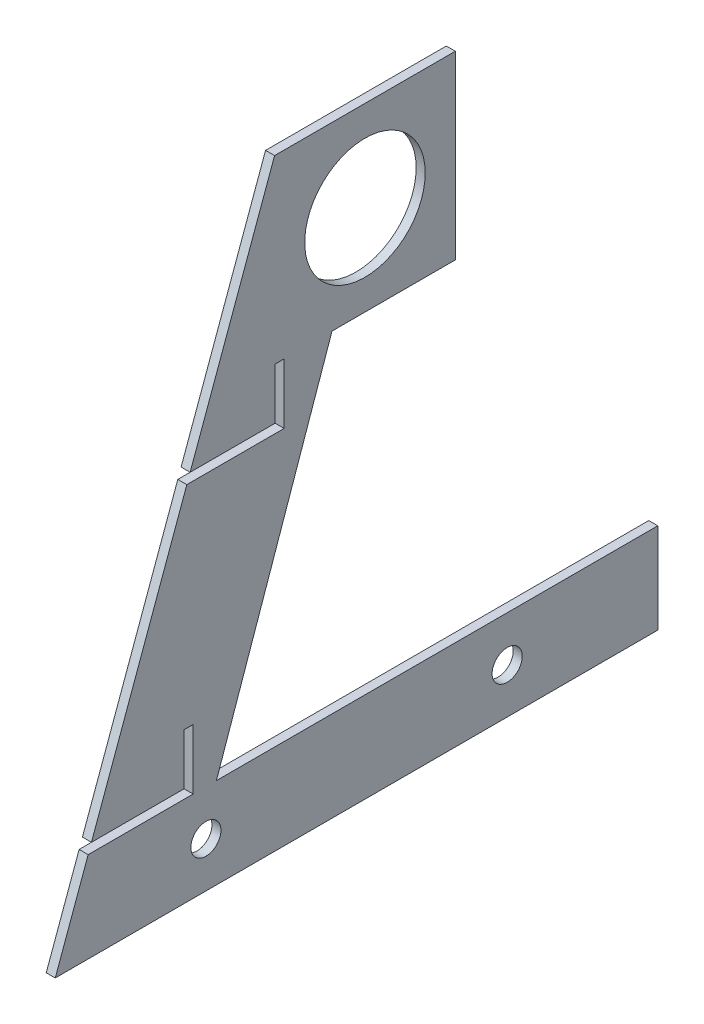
SolidWorks part; units mm, degrees
ref_plane "Front Plane" through (0, 0, 0) normal (0, 0, 1) x (1, 0, 0)
ref_plane "Top Plane" through (0, 0, 0) normal (0, 1, 0) x (1, 0, 0)
ref_plane "Right Plane" through (0, 0, 0) normal (1, 0, 0) x (0, 0, -1)
sketch "Sketch1" plane through (0, 0, 0) normal (1, 0, 0) x (0, 0, -1)
  line L0 (-86.9836, -44.466) -> (-48.5971, 65.5643)
  line L1 (-94.6925, -44.466) -> (-129.5508, -44.466)
  line L2 (-7.6648, 125.5643) -> (-67.6648, 125.5643)
  line L3 (59.5412, -74.466) -> (-140.4699, -74.466)
  line L4 (59.5412, -44.466) -> (59.5412, -74.466)
  line L5 (-140.4588, -74.4357) -> (-129.5508, -44.466)
  line L6 (-7.6648, 125.5643) -> (-7.6648, 65.5643)
  line L7 (-86.9836, -44.466) -> (59.5412, -44.466)
  line L8 (-7.6648, 65.5643) -> (-48.5971, 65.5643)
  line L9 (-128.4588, -41.466) -> (-96.7934, 45.534)
  line L10 (-94.6925, -44.466) -> (-94.6925, -24.466)
  line L11 (-94.6925, -24.466) -> (-97.6925, -24.466)
  line L12 (-97.6925, -24.466) -> (-97.6925, -41.466)
  line L13 (-97.6925, -41.466) -> (-128.4588, -41.466)
  line L14 (-140.4588, -74.4357) -> (-140.4699, -74.466)
  line L15 (-64.4793, 45.534) -> (-96.7934, 45.534)
  line L16 (-95.7015, 48.534) -> (-67.6648, 125.5643)
  line L17 (-64.4793, 65.534) -> (-64.4793, 45.534)
  line L18 (-64.4793, 65.534) -> (-67.4793, 65.534)
  line L20 (-67.4793, 65.534) -> (-67.4793, 48.534)
  line L28 (-95.7015, 48.534) -> (-67.4793, 48.534)
  circle A0 centre (-37.6648, 95.5643) radius 20
  circle A1 centre (9.5412, -59.466) radius 5
  circle A2 centre (-90.4588, -59.466) radius 5
extrude "Boss-Extrude1" add sketch "Sketch1" along normal blind 3
